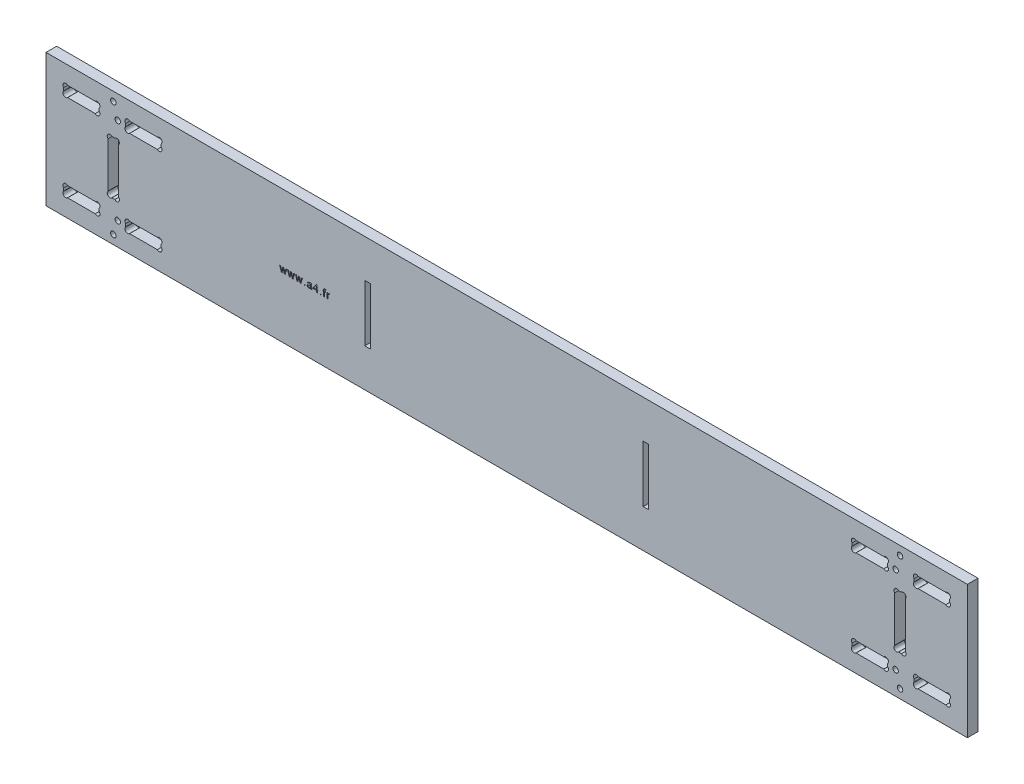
SolidWorks part; units mm, degrees
ref_plane "Plan de face" through (0, 0, 0) normal (0, 0, 1) x (1, 0, 0)
ref_plane "Plan de dessus" through (0, 0, 0) normal (0, 1, 0) x (1, 0, 0)
ref_plane "Plan de droite" through (0, 0, 0) normal (1, 0, 0) x (0, 0, -1)
sketch "Esquisse1" plane through (0, 0, 0) normal (0, 0, 1) x (1, 0, 0)
  line L0 (260, 78.6154) -> (260, -33.8794) construction
  line L1 (10, 17.4881) -> (10, 8.7885) construction
  line L2 (10, 10) -> (13.105, 13.105) construction
  line L3 (45, 12.192) -> (45, 13.808)
  line L4 (12.192, 10) -> (27.808, 10)
  line L5 (-14.878, 37.5) -> (529.0577, 37.5) construction
  line L6 (10, 12.192) -> (10, 13.808)
  line L7 (20, -1.5157) -> (20, 2.6179) construction
  line L8 (35, 53.6096) -> (35, 21.1383) construction
  line L9 (5, 16) -> (68.6522, 16) construction
  line L10 (45, 5.0886) -> (45, 18.488) construction
  line L11 (37.5, 1.6784) -> (37.5, -1.5157) construction
  line L12 (65, 18.488) -> (65, 4.2887) construction
  line L13 (5.8028, 10) -> (68.6522, 10) construction
  line L14 (75, -10.696) -> (75, 79.834) construction
  line L15 (7.4247, 13) -> (68.6522, 13) construction
  line L16 (12.192, 16) -> (27.808, 16)
  line L17 (30, 12.192) -> (30, 13.808)
  line L18 (62.808, 10) -> (47.192, 10)
  line L19 (62.808, 16) -> (47.192, 16)
  line L20 (65, 12.192) -> (65, 13.808)
  line L21 (65, 62.808) -> (65, 61.192)
  line L22 (62.808, 65) -> (47.192, 65)
  line L23 (62.808, 59) -> (47.192, 59)
  line L24 (45, 62.808) -> (45, 61.192)
  line L25 (30, 62.808) -> (30, 61.192)
  line L26 (12.192, 65) -> (27.808, 65)
  line L27 (12.192, 59) -> (27.808, 59)
  line L28 (10, 62.808) -> (10, 61.192)
  line L29 (183, 58.4524) -> (183, 16.8835) construction
  line L30 (179.9, 58.4524) -> (179.9, 16.8835) construction
  line L31 (41, 53.5) -> (41, 20.6443) construction
  line L32 (340.1, 21.5) -> (337, 21.5)
  line L33 (35, 22.5) -> (43.1551, 30.6551) construction
  line L34 (38, 32.3637) -> (38, 46.5184) construction
  line L35 (-11.0005, 52.5) -> (283.2076, 52.5) construction
  line L36 (37.192, 52.5) -> (38.808, 52.5)
  line L37 (283.2076, 22.5) -> (-22.3709, 22.5) construction
  line L38 (40.5, 15.1299) -> (40.5, 6.9947) construction
  line L39 (35, 50.308) -> (35, 24.692)
  line L40 (37.192, 22.5) -> (38.808, 22.5)
  line L41 (41, 24.692) -> (41, 50.308)
  line L42 (337, 53.5) -> (337, 21.5)
  line L43 (28.904, 5) -> (37.5, 5) construction
  line L44 (179.9, 53.5) -> (183, 53.5)
  line L45 (179.9, 53.5) -> (179.9, 21.5)
  line L46 (179.9, 21.5) -> (183, 21.5)
  line L47 (340.1, 53.5) -> (340.1, 21.5)
  line L48 (340.1, 53.5) -> (337, 53.5)
  line L49 (485, 50.308) -> (485, 24.692)
  line L50 (479, 24.692) -> (479, 50.308)
  line L51 (482.808, 22.5) -> (481.192, 22.5)
  line L52 (482.808, 52.5) -> (481.192, 52.5)
  line L53 (455, 12.192) -> (455, 13.808)
  line L54 (457.192, 10) -> (472.808, 10)
  line L55 (457.192, 16) -> (472.808, 16)
  line L56 (475, 12.192) -> (475, 13.808)
  line L57 (490, 12.192) -> (490, 13.808)
  line L58 (507.808, 10) -> (492.192, 10)
  line L59 (507.808, 16) -> (492.192, 16)
  line L60 (510, 12.192) -> (510, 13.808)
  line L61 (510, 62.808) -> (510, 61.192)
  line L62 (507.808, 59) -> (492.192, 59)
  line L63 (507.808, 65) -> (492.192, 65)
  line L64 (490, 62.808) -> (490, 61.192)
  line L65 (475, 62.808) -> (475, 61.192)
  line L66 (457.192, 59) -> (472.808, 59)
  line L67 (457.192, 65) -> (472.808, 65)
  line L68 (455, 62.808) -> (455, 61.192)
  line L70 (178.7085, 53.5) -> (185.2842, 53.5) construction
  line L71 (183, 53.5) -> (183, 21.5)
  line L72 (185.2842, 21.5) -> (178.2511, 21.5) construction
  line L74 (0, 75) -> (520, 75)
  line L75 (0, 75) -> (0, 0)
  line L76 (0, 0) -> (520, 0)
  line L77 (520, 75) -> (520, 0)
  arc A0 (10, 12.192) -> (12.192, 10) centre (11.096, 11.096) ccw
  circle A1 centre (40.5, 13) radius 1.55
  circle A2 centre (38, 5) radius 1.55
  arc A3 (10, 13.808) -> (12.192, 16) centre (11.096, 14.904) cw
  arc A4 (30, 12.192) -> (27.808, 10) centre (28.904, 11.096) cw
  arc A5 (30, 13.808) -> (27.808, 16) centre (28.904, 14.904) ccw
  arc A6 (45, 13.808) -> (47.192, 16) centre (46.096, 14.904) cw
  arc A7 (45, 12.192) -> (47.192, 10) centre (46.096, 11.096) ccw
  arc A8 (65, 13.808) -> (62.808, 16) centre (63.904, 14.904) ccw
  arc A9 (65, 12.192) -> (62.808, 10) centre (63.904, 11.096) cw
  arc A10 (65, 61.192) -> (62.808, 59) centre (63.904, 60.096) cw
  arc A11 (65, 62.808) -> (62.808, 65) centre (63.904, 63.904) ccw
  arc A12 (45, 61.192) -> (47.192, 59) centre (46.096, 60.096) ccw
  arc A13 (45, 62.808) -> (47.192, 65) centre (46.096, 63.904) cw
  circle A14 centre (40.5, 62) radius 1.55
  circle A15 centre (38, 70) radius 1.55
  arc A16 (35, 24.692) -> (37.192, 22.5) centre (36.096, 23.596) ccw
  arc A17 (41, 24.692) -> (38.808, 22.5) centre (39.904, 23.596) cw
  arc A18 (35, 50.308) -> (37.192, 52.5) centre (36.096, 51.404) cw
  arc A19 (41, 50.308) -> (38.808, 52.5) centre (39.904, 51.404) ccw
  arc A20 (30, 61.192) -> (27.808, 59) centre (28.904, 60.096) cw
  arc A21 (30, 62.808) -> (27.808, 65) centre (28.904, 63.904) ccw
  arc A22 (10, 61.192) -> (12.192, 59) centre (11.096, 60.096) ccw
  arc A23 (10, 62.808) -> (12.192, 65) centre (11.096, 63.904) cw
  circle A24 centre (482, 5) radius 1.55
  circle A25 centre (482, 70) radius 1.55
  arc A26 (485, 24.692) -> (482.808, 22.5) centre (483.904, 23.596) cw
  arc A27 (479, 24.692) -> (481.192, 22.5) centre (480.096, 23.596) ccw
  arc A28 (479, 50.308) -> (481.192, 52.5) centre (480.096, 51.404) cw
  arc A29 (485, 50.308) -> (482.808, 52.5) centre (483.904, 51.404) ccw
  arc A36 (455, 13.808) -> (457.192, 16) centre (456.096, 14.904) cw
  arc A37 (455, 12.192) -> (457.192, 10) centre (456.096, 11.096) ccw
  arc A38 (475, 13.808) -> (472.808, 16) centre (473.904, 14.904) ccw
  arc A39 (475, 12.192) -> (472.808, 10) centre (473.904, 11.096) cw
  circle A40 centre (479.5, 13) radius 1.55
  arc A42 (490, 13.808) -> (492.192, 16) centre (491.096, 14.904) cw
  arc A43 (490, 12.192) -> (492.192, 10) centre (491.096, 11.096) ccw
  arc A44 (510, 13.808) -> (507.808, 16) centre (508.904, 14.904) ccw
  arc A45 (510, 12.192) -> (507.808, 10) centre (508.904, 11.096) cw
  arc A46 (510, 62.808) -> (507.808, 65) centre (508.904, 63.904) ccw
  arc A47 (510, 61.192) -> (507.808, 59) centre (508.904, 60.096) cw
  arc A48 (490, 62.808) -> (492.192, 65) centre (491.096, 63.904) cw
  arc A49 (490, 61.192) -> (492.192, 59) centre (491.096, 60.096) ccw
  circle A51 centre (479.5, 62) radius 1.55
  arc A52 (475, 62.808) -> (472.808, 65) centre (473.904, 63.904) ccw
  arc A53 (475, 61.192) -> (472.808, 59) centre (473.904, 60.096) cw
  arc A54 (455, 62.808) -> (457.192, 65) centre (456.096, 63.904) cw
  arc A55 (455, 61.192) -> (457.192, 59) centre (456.096, 60.096) ccw
  dimension "D1" = 45
  dimension "D2" = 3
  dimension "D4" = 15
  dimension "D3" = 6
  dimension "D7" = 3.1
  dimension "D8" = 1
  dimension "D9" = 1
  dimension "D5" = 30
  dimension "D6" = 45
extrude "Extrusion1" add sketch "Esquisse1" along normal blind 6
sketch "Esquisse2" plane through (0, 0, 6) normal (0, 0, 1) x (1, 0, 0)
  text T0 "www.a4.fr" font "Arial" height in points 16
extrude "Enlèv. mat.-Extru.1" cut sketch "Esquisse2" against normal blind 0.5
ref_plane "Plan1" through (0, 0, 3) normal (0, 0, 1) x (1, 0, 0)
sketch "Esquisse3" plane through (0, 0, 3) normal (0, 0, 1) x (1, 0, 0)
  text T0 "www.a4.fr" font "Arial" height 0.1
extrude "Enlèv. mat.-Extru.2" cut sketch "Esquisse3" against normal blind 0.5
